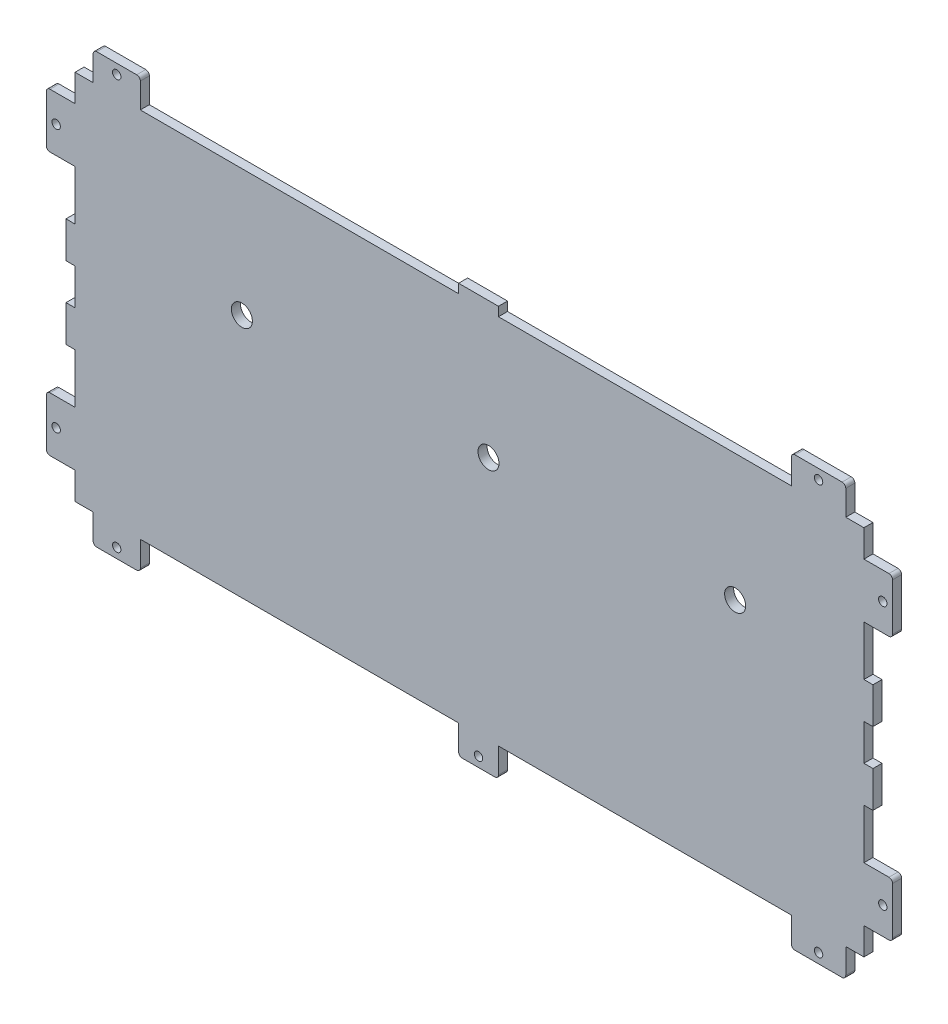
SolidWorks part; units mm, degrees
ref_plane "Front Plane" through (0, 0, 0) normal (0, 0, 1) x (1, 0, 0)
ref_plane "Top Plane" through (0, 0, 0) normal (0, 1, 0) x (1, 0, 0)
ref_plane "Right Plane" through (0, 0, 0) normal (1, 0, 0) x (0, 0, -1)
sketch "Sketch1" plane through (0, 0, 0) normal (0, 0, 1) x (1, 0, 0)
  line L0 (144.78, 85.725) -> (231.14, 85.725) construction
  line L1 (0, 0) -> (276.225, 0)
  line L2 (0, 0) -> (0, 130.175)
  line L3 (0, 130.175) -> (276.225, 130.175)
  line L4 (276.225, 0) -> (276.225, 130.175)
  line L6 (58.42, 85.725) -> (144.78, 85.725) construction
  circle A0 centre (58.42, 85.725) radius 3.683
  circle A1 centre (231.14, 85.725) radius 3.683
  circle A3 centre (144.78, 85.725) radius 3.683
  dimension "D3" = 7.366
  dimension "D1" = 130.175
  dimension "D2" = 45.085
  dimension "D4" = 276.225
  dimension "D5" = 85.725
  dimension "D6" = 86.36
extrude "Boss-Extrude1" add sketch "Sketch1" along normal blind 3.175
sketch "Sketch2" plane through (0, 0, 0) normal (0, 0, 1) x (1, 0, 0)
  line L1 (138.1125, 130.175) -> (138.1125, 0) construction
  line L2 (276.225, 130.175) -> (0, 130.175) construction
  line L3 (0, 0) -> (276.225, 0) construction
  line L4 (286.258, 9.525) -> (286.258, 28.575)
  line L6 (0, 130.175) -> (0, 0) construction
  line L7 (0, 65.0875) -> (276.225, 65.0875) construction
  line L8 (276.225, 0) -> (276.225, 130.175) construction
  line L9 (276.225, 120.65) -> (286.258, 120.65)
  line L10 (276.225, 120.65) -> (276.225, 101.6)
  line L11 (276.225, 101.6) -> (286.258, 101.6)
  line L12 (286.258, 120.65) -> (286.258, 101.6)
  line L13 (276.225, 28.575) -> (286.258, 28.575)
  line L15 (276.225, 9.525) -> (276.225, 28.575)
  line L16 (276.225, 9.525) -> (286.258, 9.525)
  line L17 (-3.175, 84.1375) -> (-3.175, 71.4375)
  line L18 (276.225, 84.1375) -> (279.4, 84.1375)
  line L19 (276.225, 84.1375) -> (276.225, 71.4375)
  line L20 (276.225, 71.4375) -> (279.4, 71.4375)
  line L21 (279.4, 84.1375) -> (279.4, 71.4375)
  line L22 (0, 71.4375) -> (-3.175, 71.4375)
  line L23 (0, 84.1375) -> (0, 71.4375)
  line L24 (0, 84.1375) -> (-3.175, 84.1375)
  line L25 (0, 9.525) -> (-10.033, 9.525)
  line L26 (0, 9.525) -> (0, 28.575)
  line L27 (0, 28.575) -> (-10.033, 28.575)
  line L29 (-10.033, 120.65) -> (-10.033, 101.6)
  line L30 (0, 101.6) -> (-10.033, 101.6)
  line L31 (0, 120.65) -> (0, 101.6)
  line L32 (0, 120.65) -> (-10.033, 120.65)
  line L33 (-10.033, 9.525) -> (-10.033, 28.575)
  line L34 (279.4, 46.0375) -> (279.4, 58.7375)
  line L35 (6.35, 0) -> (22.86, 0)
  line L36 (6.35, 0) -> (6.35, -10.033)
  line L37 (6.35, -10.033) -> (22.86, -10.033)
  line L38 (22.86, 0) -> (22.86, -10.033)
  line L39 (134.3025, 0) -> (148.2725, 0)
  line L40 (134.3025, 0) -> (134.3025, -10.033)
  line L41 (134.3025, -10.033) -> (148.2725, -10.033)
  line L42 (148.2725, 0) -> (148.2725, -10.033)
  line L43 (250.825, 0) -> (269.875, 0)
  line L44 (250.825, 0) -> (250.825, -10.033)
  line L45 (250.825, -10.033) -> (269.875, -10.033)
  line L46 (269.875, 0) -> (269.875, -10.033)
  line L47 (6.35, 130.175) -> (22.86, 130.175)
  line L48 (6.35, 130.175) -> (6.35, 140.208)
  line L49 (6.35, 140.208) -> (22.86, 140.208)
  line L50 (22.86, 130.175) -> (22.86, 140.208)
  line L51 (250.825, 130.175) -> (269.875, 130.175)
  line L52 (250.825, 130.175) -> (250.825, 140.208)
  line L53 (250.825, 140.208) -> (269.875, 140.208)
  line L54 (269.875, 130.175) -> (269.875, 140.208)
  line L55 (134.3025, 130.175) -> (148.2725, 130.175)
  line L56 (134.3025, 130.175) -> (134.3025, 133.35)
  line L57 (134.3025, 133.35) -> (148.2725, 133.35)
  line L58 (148.2725, 130.175) -> (148.2725, 133.35)
  line L59 (276.225, 58.7375) -> (279.4, 58.7375)
  line L60 (276.225, 46.0375) -> (276.225, 58.7375)
  line L61 (276.225, 46.0375) -> (279.4, 46.0375)
  line L62 (0, 46.0375) -> (-3.175, 46.0375)
  line L63 (0, 46.0375) -> (0, 58.7375)
  line L64 (0, 58.7375) -> (-3.175, 58.7375)
  line L65 (-3.175, 46.0375) -> (-3.175, 58.7375)
  point P62 (141.2875, -10.033)
  dimension "D1" = 19.05
  dimension "D2" = 10.033
  dimension "D3" = 9.525
  dimension "D4" = 10.033
  dimension "D5" = 6.35
  dimension "D6" = 6.35
  dimension "D7" = 3.175
  dimension "D8" = 16.51
  dimension "D9" = 13.97
  dimension "D10" = 19.05
  dimension "D11" = 10.033
  dimension "D12" = 3.175
  dimension "D13" = 3.175
  dimension "D14" = 12.7
  dimension "D15" = 6.35
extrude "Boss-Extrude2" add sketch "Sketch2" along normal blind 3.175
hole_wizard "#4 Clearance Hole1" positions "Sketch4" profile "Sketch3" hole size "#4" standard "ANSI Inch"
sketch "Sketch4" plane through (0, 0, 3.175) normal (0, 0, 1) x (1, 0, 0)
  line L0 (148.2725, 0) -> (250.825, 0) construction
  line L1 (134.3025, -10.033) -> (148.2725, -10.033) construction
  line L2 (6.35, -10.033) -> (22.86, -10.033) construction
  line L3 (250.825, -10.033) -> (269.875, -10.033) construction
  line L8 (276.225, 120.65) -> (276.225, 130.175) construction
  line L9 (286.258, 101.6) -> (286.258, 120.65) construction
  line L10 (138.1125, 111.125) -> (138.1125, 19.05) construction
  line L12 (0, 65.0875) -> (276.225, 65.0875) construction
  line L13 (0, 71.4375) -> (0, 58.7375) construction
  line L14 (276.225, 58.7375) -> (276.225, 71.4375) construction
  point P0 (14.605, -6.604)
  point P2 (141.2875, -6.604)
  point P4 (260.35, -6.604)
  point P11 (141.2875, -10.033)
  point P14 (14.605, -10.033)
  point P17 (260.35, -10.033)
  point P29 (282.829, 111.125)
  point P38 (286.258, 111.125)
  point P47 (-6.604, 111.125)
  point P49 (138.1125, 65.0875)
  point P64 (138.1125, 65.0875)
  point P67 (260.35, 136.779)
  point P68 (14.605, 136.779)
  point P70 (282.829, 19.05)
  point P71 (-6.604, 19.05)
  dimension "D1" = 6.604
  dimension "D2" = 6.604
sketch "Sketch3" plane through (14.605, -6.604, 3.175) normal (1, 0, 0) x (0, -1, 0)
  line L0 (0, 0) -> (0, 3.1751)
  line L1 (0, 3.1751) -> (1.4732, 3.1751)
  line L2 (1.4732, 3.1751) -> (1.4732, 0)
  line L5 (1.4732, 0) -> (0, 0)
  line L11 (0, -6.35) -> (0, 107.95) construction
  dimension "Thru Hole Dia." = 2.9464
  dimension "Thru Hole Depth" = 3.1751
fillet "Fillet1" radius 1.27 18 edges at (22.86, -10.033, 1.5875) (134.3025, -10.033, 1.5875) (148.2725, -10.033, 1.5875) (250.825, -10.033, 1.5875) (269.875, -10.033, 1.5875) (286.258, 9.525, 1.5875) (286.258, 28.575, 1.5875) (286.258, 101.6, 1.5875) (286.258, 120.65, 1.5875) (269.875, 140.208, 1.5875) (250.825, 140.208, 1.5875) (22.86, 140.208, 1.5875) (6.35, 140.208, 1.5875) (-10.033, 120.65, 1.5875) (-10.033, 101.6, 1.5875) (-10.033, 28.575, 1.5875) (-10.033, 9.525, 1.5875) (6.35, -10.033, 1.5875)
